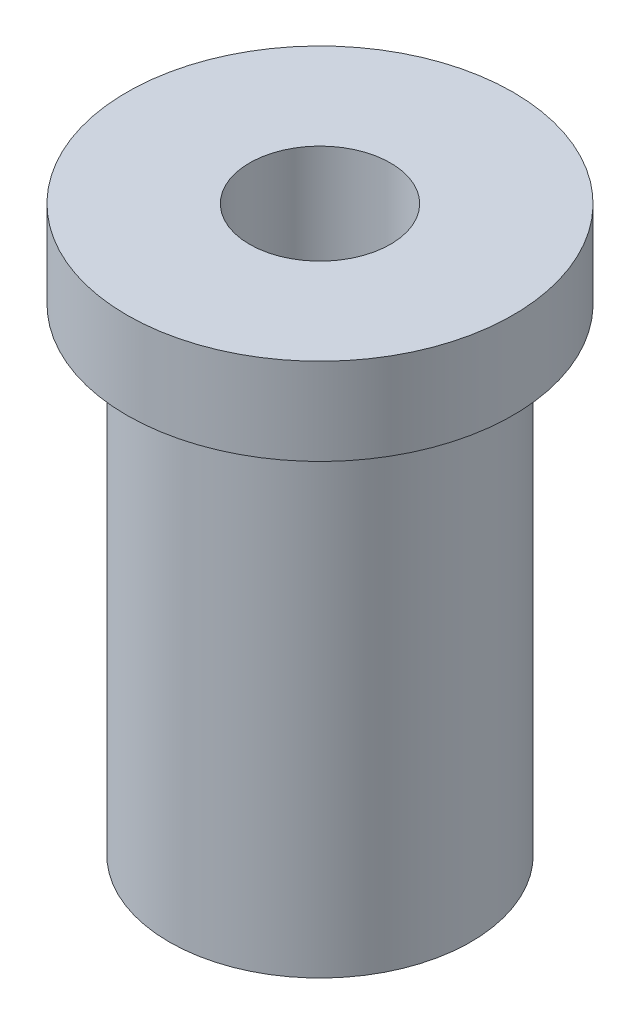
SolidWorks part; units mm, degrees
ref_plane "Přední rovina" through (0, 0, 0) normal (0, 0, 1) x (1, 0, 0)
ref_plane "Horní rovina" through (0, 0, 0) normal (0, 1, 0) x (1, 0, 0)
ref_plane "Pravá rovina" through (0, 0, 0) normal (1, 0, 0) x (0, 0, -1)
sketch "Skica1" plane through (0, 0, 0) normal (0, 1, 0) x (1, 0, 0)
  circle A0 centre (0, 0) radius 6.95
  dimension "D1" = 13.9
extrude "Přidat vysunutím1" add sketch "Skica1" along normal blind 22
sketch "Skica2" plane through (0, 22, 0) normal (0, 1, 0) x (-1, 0, 0)
  circle A0 centre (0, 0) radius 8.9
  dimension "D1" = 17.8
extrude "Přidat vysunutím2" add sketch "Skica2" along normal blind 4
fillet "Zaoblit1" radius 0.3 1 edges at (0, 22, 6.95)
sketch "Skica3" plane through (0, 26, 0) normal (0, 1, 0) x (1, 0, 0)
  circle A0 centre (0, 0) radius 3.25
  dimension "D1" = 6.5
extrude "Odebrat vysunutím1" cut sketch "Skica3" against normal through all
